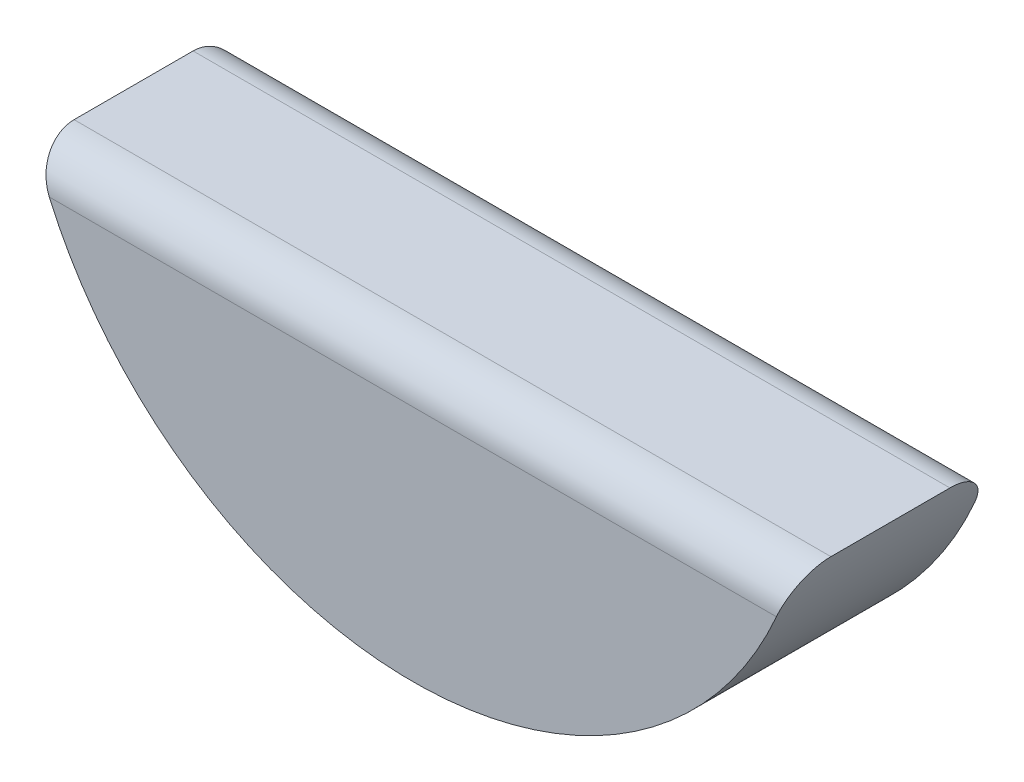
SolidWorks part; units mm, degrees
ref_plane "Front" through (0, 0, 0) normal (0, 0, 1) x (1, 0, 0)
ref_plane "Top" through (0, 0, 0) normal (0, 1, 0) x (1, 0, 0)
ref_plane "Right" through (0, 0, 0) normal (1, 0, 0) x (0, 0, -1)
other "Configuration Table"
sketch "Sketch1" plane through (0, 0, 0) normal (0, 0, 1) x (1, 0, 0)
  line L0 (-1.9079, 0) -> (1.9079, 0)
  arc A0 (-1.9079, 0) -> (1.9079, 0) centre (0, 0.6) ccw
  dimension "d2" = 4
  dimension "h" = 1.4
extrude "Extrude1" add sketch "Sketch1" along normal mid plane 1
fillet "Fillet1" radius 0.2 2 edges at (0, 0, -0.5) (0, 0, 0.5)
